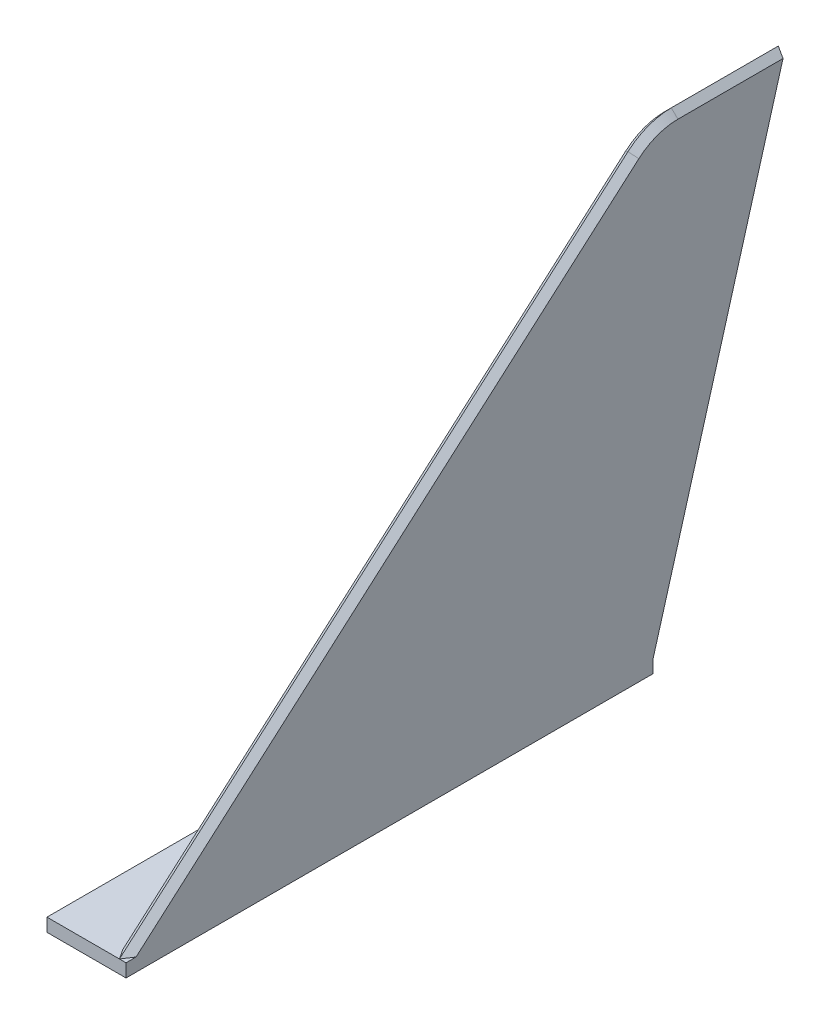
SolidWorks part; units mm, degrees
ref_plane "Plan de face" through (0, 0, 0) normal (0, 0, 1) x (1, 0, 0)
ref_plane "Plan de dessus" through (0, 0, 0) normal (0, 1, 0) x (1, 0, 0)
ref_plane "Plan de droite" through (0, 0, 0) normal (1, 0, 0) x (0, 0, -1)
sketch "Esquisse1" plane through (0, 0, 0) normal (1, 0, 0) x (0, 0, -1)
  line L0 (0, 0) -> (-80, 0)
  line L1 (-80, 0) -> (-2.8277, 67.5258)
  line L2 (3.7574, 70) -> (20, 70)
  line L3 (20, 70) -> (0, 0)
  arc A0 (-2.8277, 67.5258) -> (3.7574, 70) centre (3.7574, 60) cw
  point P7 (0, 70)
  dimension "D4" = 10
  dimension "D1" = 80
  dimension "D2" = 20
  dimension "D3" = 70
extrude "Extrusion1" add sketch "Esquisse1" along normal mid plane 2
chamfer "Chanfrein1" distance 1 angle 45 6 edges at (-1, 70, -11.8787) (-1, 69.361, -0.2401) (-1, 33.7629, 41.4138) (1, 70, -11.8787) (1, 69.361, -0.2401) (1, 33.7629, 41.4138)
sketch "Esquisse2" plane through (0, 0, 0) normal (0, -1, 0) x (1, 0, 0)
  line L1 (1, 0) -> (-11, 0)
  line L2 (1, 0) -> (1, 80)
  line L3 (1, 80) -> (-11, 80)
  line L4 (-11, 0) -> (-11, 80)
  dimension "D1" = 12
extrude "Extrusion2" add sketch "Esquisse2" along normal blind 2
